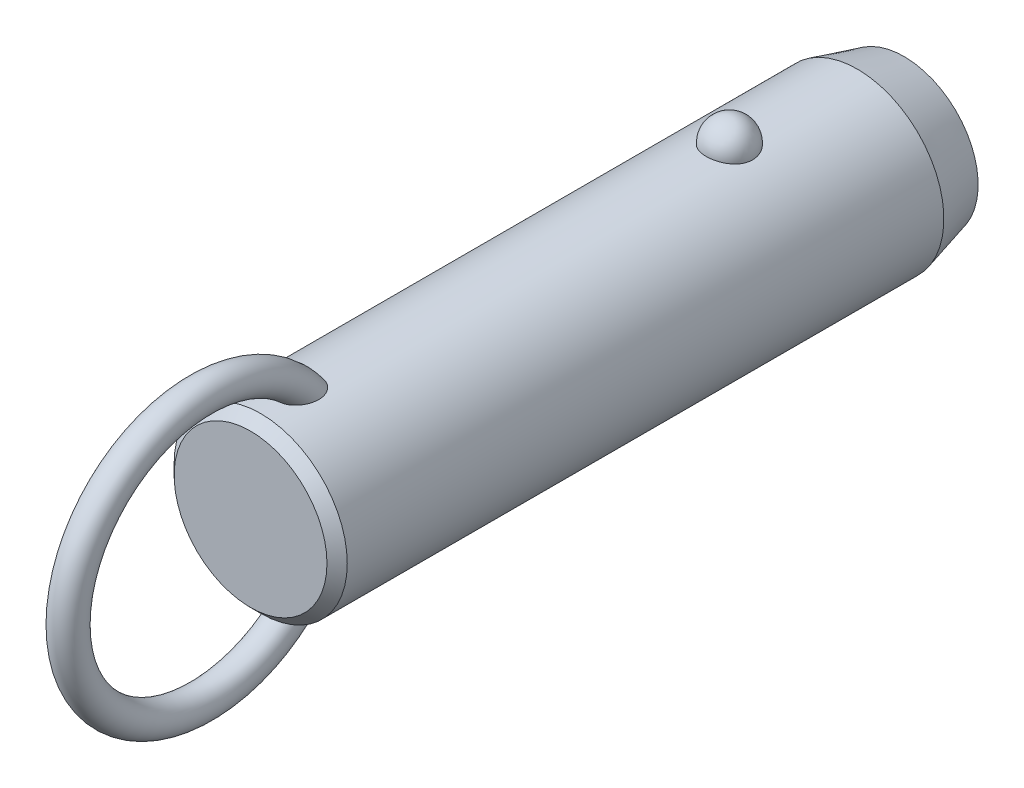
SolidWorks part; units mm, degrees
ref_plane "Front Plane" through (0, 0, 0) normal (0, 0, 1) x (1, 0, 0)
ref_plane "Top Plane" through (0, 0, 0) normal (0, 1, 0) x (1, 0, 0)
ref_plane "Right Plane" through (0, 0, 0) normal (1, 0, 0) x (0, 0, -1)
sketch "Sketch2" plane through (0, 0, 0) normal (0, 0, 1) x (1, 0, 0)
  circle A0 centre (0, 0) radius 11.1
  point P3 (0, 11.1)
  dimension "D1" = 22.2
extrude "Boss-Extrude1" add sketch "Sketch2" along normal blind 45.7
sketch "Sketch3" plane through (0, 0, 0) normal (0, 0, -1) x (-1, 0, 0)
  circle A0 centre (0, 0) radius 11.1
  dimension "D1" = 22.2
extrude "Boss-Extrude2" add sketch "Sketch3" along normal blind 25.4
chamfer "Chamfer1" distance 6 angle 15 1 edges at (-11.1, 0, -25.4)
sketch "Sketch12" plane through (0, 0, 0) normal (1, 0, 0) x (0, 0, -1)
  line L0 (-45.7, 11.1) -> (-45.7, -11.1) construction
  point P0 (-45.7, 0)
sketch "Sketch13" plane through (0, 0, 0) normal (1, 0, 0) x (0, 0, -1)
  circle A0 centre (-64.75, 0) radius 19.05
  point P2 (-45.7, 0)
  dimension "D1" = 38.1
sketch "Sketch14" plane through (0, 0, 0) normal (0, 1, 0) x (1, 0, 0)
  circle A0 centre (0, -47.7) radius 2
  point P2 (0, -45.7)
  dimension "D1" = 4
sweep "Sweep1" add profiles "Sketch14" path "Sketch13"
sketch "Sketch15" plane through (0, 0, 45.7) normal (0, 0, 1) x (1, 0, 0)
  circle A0 centre (0, 0) radius 11.1
  dimension "D1" = 22.2
extrude "Boss-Extrude3" add sketch "Sketch15" along normal blind 12.7
chamfer "Chamfer2" distance 1.3 angle 45 1 edges at (11.1, 0, 58.4)
sketch "Sketch18" plane through (0, 0, 0) normal (1, 0, 0) x (0, 0, -1)
  line L0 (19.4, 11.1) -> (-49.268, 11.1) construction
  line L1 (3, 14.1) -> (3, 8.1)
  line L2 (-49.268, -11.1) -> (19.4, -11.1) construction
  arc A0 (3, 14.1) -> (3, 8.1) centre (3, 11.1) ccw
  point P4 (0, 11.1)
  dimension "D1" = 25.2
revolve "Revolve1" add sketch "Sketch18" angle 360 about L1
